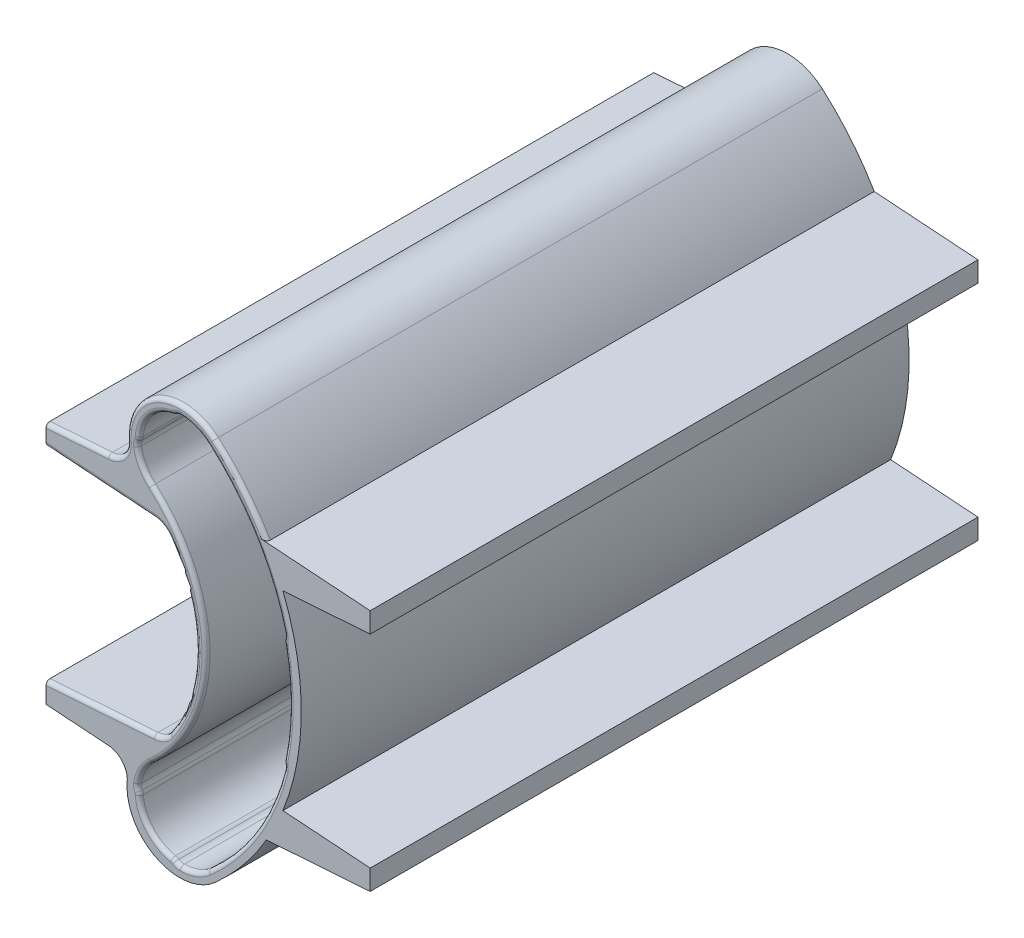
SolidWorks part; units mm, degrees
ref_plane "Front Plane" through (0, 0, 0) normal (0, 0, 1) x (1, 0, 0)
ref_plane "Top Plane" through (0, 0, 0) normal (0, 1, 0) x (1, 0, 0)
ref_plane "Right Plane" through (0, 0, 0) normal (1, 0, 0) x (0, 0, -1)
sketch "Sketch1" plane through (0, 0, 0) normal (0, 0, 1) x (1, 0, 0)
  line L0 (0, 0) -> (126.5517, 0) construction
  line L1 (0, 0) -> (65.9983, -75.128) construction
  line L2 (0, 0) -> (65.9983, 75.128) construction
  arc A9 (48.8388, -55.5947) -> (83.1579, -94.6613) centre (65.9983, -75.128) ccw
  arc A10 (83.1579, -94.6613) -> (83.1579, 94.6613) centre (0, 0) ccw
  arc A11 (83.1579, 94.6613) -> (48.8388, 55.5947) centre (65.9983, 75.128) ccw
  arc A12 (48.8388, -55.5947) -> (48.8388, 55.5947) centre (0, 0) ccw
  arc A13 (52.1387, -59.3512) -> (79.858, -90.9049) centre (65.9983, -75.128) ccw
  arc A14 (52.1387, -59.3512) -> (52.1387, 59.3512) centre (0, 0) ccw
  arc A15 (79.858, 90.9049) -> (52.1387, 59.3512) centre (65.9983, 75.128) ccw
  arc A16 (79.858, -90.9049) -> (79.858, 90.9049) centre (0, 0) ccw
  dimension "D1" = 79
  dimension "D2" = 42
  dimension "D3" = 5
  dimension "D4" = 48.701
extrude "Extrude1" add sketch "Sketch1" along normal blind 300
sketch "Sketch3" plane through (0, 0, 0) normal (1, 0, 0) x (0, 0, -1)
  line L0 (17.1923, 0) -> (-312.4893, 0) construction
  line L1 (0, -55.5947) -> (0, 55.5947) construction
  line L4 (-300, -50) -> (0, -50)
  line L5 (-300, -50) -> (-300, -60)
  line L6 (-300, -60) -> (0, -60)
  line L7 (0, -50) -> (0, -60)
  line L8 (-300, 55.5947) -> (-300, -55.5947) construction
  dimension "D1" = 10
  dimension "D2" = 100
extrude "Extrude2" add sketch "Sketch3" along normal up to body
draft "Draft1" type of draft neutral plane draft angle 4 faces to draft 2 parameters "D1"=4
ref_plane "Plane3" through (160, 0, 0) normal (1, 0, 0) x (0, 0, -1)
sketch "Sketch10" plane through (160, 0, 0) normal (1, 0, 0) x (0, 0, -1)
  line L4 (-300, -50) -> (-300, -60)
  line L5 (0, -50) -> (-300, -50)
  line L6 (0, -60) -> (0, -50)
  line L7 (-300, -60) -> (0, -60)
  line L8 (-300, -50) -> (-300, -60)
  line L9 (0, -50) -> (-300, -50)
  line L10 (0, -60) -> (0, -50)
  line L11 (-300, -60) -> (0, -60)
  dimension "D1" = 0
extrude "Extrude6" add sketch "Sketch10" against normal up to body
draft "Draft2" type of draft neutral plane draft angle 4 faces to draft 2 parameters "D1"=4
mirror "Mirror1" about plane through (0, 0, 0) normal (0, 1, 0) of "Draft2", "Extrude6", "Draft1", "Extrude2"
fillet "Fillet1" radius 10 4 edges at (42.9968, -63.0066, 150) (42.9968, 63.0066, 150) (58.0103, -45.9435, 150) (58.0103, 45.9435, 150)
ref_plane "Plane1" through (0, 0, 50) normal (0, 0, 1) x (1, 0, 0)
sketch "Sketch4" plane through (0, 0, 50) normal (0, 0, 1) x (1, 0, 0)
  line L0 (0, -33.0385) -> (0, 33.0385) construction
  circle A1 centre (65, 0) radius 3.75
  arc A2 (62.9654, 9.7908) -> (62.9654, -9.7908) centre (65, 0) ccw
  arc A3 (60.9541, -41.9594) -> (60.9541, 41.9594) centre (0, 0) ccw construction
  arc A4 (70.4512, -22.6413) -> (70.4512, 22.6413) centre (0, 0) ccw
  arc A5 (70.4512, -22.6413) -> (62.9654, -9.7908) centre (60.9308, -19.5817) ccw
  arc A6 (70.4512, 22.6413) -> (62.9654, 9.7908) centre (60.9308, 19.5817) cw
  point P13 (74, 0)
  dimension "D2" = 7.5
  dimension "D3" = 20
  dimension "D4" = 10
  dimension "D1" = 65
extrude "Extrude3" add sketch "Sketch4" along normal blind 25
sketch "Sketch5" plane through (0, 0, 0) normal (1, 0, 0) x (0, 0, -1)
  line L0 (0, 0) -> (-27.1601, 0) construction
  line L1 (-45, 40) -> (-40, 40)
  line L2 (-45, 40) -> (-45, -40)
  line L3 (-45, -40) -> (-40, -40)
  line L4 (-40, 40) -> (-40, -40)
  line L5 (0, -41.9594) -> (0, 41.9594) construction
  line L6 (-42.5, -40) -> (-42.5, 40) construction
  line L7 (-50, -9.7908) -> (-50, 9.7908) construction
  dimension "D1" = 5
  dimension "D2" = 5
  dimension "D3" = 80
extrude "Cut-Extrude2" cut sketch "Sketch5" along normal up to next contours L2 L3 L4 L1
pattern_linear "LPattern1" count 2 spacing 17.5 along (0, 0, -1) of "Cut-Extrude2"
sketch "Sketch7" plane through (0, 0, 300) normal (0, 0, 1) x (1, 0, 0)
  line L0 (65.9983, -75.128) -> (48.7189, -90.3077) construction
  line L1 (65.9983, 75.128) -> (48.7189, 90.3077) construction
  line L2 (46.0035, 75.5813) -> (43.0042, 75.6493)
  line L3 (62.5188, 97.8633) -> (62.9726, 94.8978)
  line L4 (62.5188, -97.8633) -> (62.9726, -94.8978)
  line L5 (46.0035, -75.5813) -> (43.0042, -75.6493)
  line L10 (0, 0) -> (123, 0) construction
  line L12 (117.1555, -25.9728) -> (120.0844, -26.6221)
  line L13 (120.0844, 26.6221) -> (117.1555, 25.9728)
  arc A0 (43.0042, 75.6493) -> (62.5188, 97.8633) centre (65.9983, 75.128) cw
  arc A1 (46.0035, 75.5813) -> (62.9726, 94.8978) centre (65.9983, 75.128) cw
  arc A2 (46.0035, -75.5813) -> (62.9726, -94.8978) centre (65.9983, -75.128) ccw
  arc A6 (43.0042, -75.6493) -> (62.5188, -97.8633) centre (65.9983, -75.128) ccw
  arc A11 (79.858, -90.9049) -> (79.858, 90.9049) centre (0, 0) ccw construction
  arc A12 (120.0844, -26.6221) -> (120.0844, 26.6221) centre (0, 0) ccw
  arc A13 (117.1555, -25.9728) -> (117.1555, 25.9728) centre (0, 0) ccw
  arc A15 (52.1387, -59.3512) -> (79.858, -90.9049) centre (65.9983, -75.128) ccw construction
  dimension "D1" = 3
  dimension "D2" = 1
  dimension "D3" = 1
  dimension "D4" = 2
  dimension "D5" = 80
  dimension "D6" = 25
extrude "Extrude4" add sketch "Sketch7" against normal up to surface (300 mm away)
fillet "Fillet2" radius 5 6 edges at (118.1318, 26.1892, 150) (118.1318, -26.1892, 150) (62.8213, -95.8863, 150) (45.0037, -75.604, 150) (45.0037, 75.604, 150) (62.8213, 95.8863, 150)
fillet "Fillet3" radius 5 6 edges at (62.9726, 94.8978, 150) (46.0035, 75.5813, 150) (46.0035, -75.5813, 150) (62.9726, -94.8978, 150) (117.1555, 25.9728, 150) (117.1555, -25.9728, 150)
fillet "Fillet4" radius 2 62 edges at (26.7073, 48.1324, 0) (26.7073, 48.1324, 300) (57.676, 44.9731, 0) (57.676, 44.9731, 300) (74, 0, 0) (74, 0, 300) (57.676, -44.9731, 0) (57.676, -44.9731, 300) (15.4104, -61.0776, 0) (37.7146, -65.6215, 0) (97.2196, -80.152, 0) (97.2196, 80.152, 300) (73.5612, -94.7189, 0) (73.5612, -94.7189, 300) (64.9205, -95.9446, 0) (64.9205, -95.9446, 300) (62.8257, -94.9734, 0) (62.8257, -94.9734, 300) (50.9727, -88.3277, 0) (45.9096, -75.7173, 0) (45.9096, -75.7173, 300) (45.2163, -73.5148, 300) (45.2163, -73.5148, 0) (47.5452, -65.104, 300) (47.5452, -65.104, 0) (79, 0, 0) (79, 0, 300) (47.5452, 65.104, 0) (47.5452, 65.104, 300) (45.2163, 73.5148, 0) (45.2163, 73.5148, 300) (45.9096, 75.7173, 0) (45.9096, 75.7173, 300) (50.9727, 88.3277, 0) (62.8257, 94.9734, 0) (62.8257, 94.9734, 300) (64.9205, 95.9446, 300) (64.9205, 95.9446, 0) (73.5612, 94.7189, 300) (73.5612, 94.7189, 0) (103.3575, 62.9144, 0) (103.3575, 62.9144, 300) (117.5752, 28.0226, 0) (117.5752, 28.0226, 300) (117.3216, 25.7849, 0) (117.3216, 25.7849, 300) (120, 0, 0) (117.3216, -25.7849, 0) (117.3216, -25.7849, 300) (117.5752, -28.0226, 300) (117.5752, -28.0226, 0) (26.7073, -48.1324, 300) (15.4104, 61.0776, 300) (37.7146, 65.6215, 300) (120, 0, 300) (103.3575, -62.9144, 300) (103.3575, -62.9144, 0) (50.9727, -88.3277, 300) (50.9727, 88.3277, 300) (26.7073, -48.1324, 0) (54.3004, -98.3478, 0) (54.3004, 98.3478, 300)
fillet "Fillet5" radius 2.5 6 edges at (69.5716, 14.5481, 50) (55, 0, 50) (69.5716, 14.5481, 75) (55, 0, 75) (69.5716, -14.5481, 50) (69.5716, -14.5481, 75)
fillet "Fillet6" radius 2 6 edges at (71.7237, -18.2131, 50.5965) (71.7237, 18.2131, 50.5965) (71.7237, -18.2131, 74.4035) (71.7237, 18.2131, 74.4035) (74, 0, 50) (74, 0, 75)
ref_plane "Plane2" through (0, 0, 104) normal (0, 0, -1) x (-1, 0, 0)
sketch "Sketch8" plane through (0, 0, 104) normal (0, 0, -1) x (-1, 0, 0)
  line L3 (0, 0) -> (-54.25, 0) construction
  line L4 (-60.6048, 24.1788) -> (-60.6048, -24.1788) construction
  line L6 (-36.4496, 26.4026) -> (-66.1706, 33.1279)
  line L7 (-66.1706, -33.1279) -> (-36.4496, -26.4026)
  line L8 (-30.6048, -19.0875) -> (-30.6048, 19.0875)
  arc A5 (-60.9541, 41.9594) -> (-60.9541, -41.9594) centre (0, 0) ccw construction
  arc A6 (-66.1706, 33.1279) -> (-66.1706, -33.1279) centre (0, 0) ccw
  circle A7 centre (-54.25, 0) radius 25 construction
  circle A12 centre (-60.6048, -24.1788) radius 2.5
  arc A13 (-36.4496, -26.4026) -> (-30.6048, -19.0875) centre (-38.1048, -19.0875) ccw
  arc A14 (-30.6048, 19.0875) -> (-36.4496, 26.4026) centre (-38.1048, 19.0875) ccw
  circle A15 centre (-38.1048, -19.0875) radius 2.5
  circle A16 centre (-38.1048, 19.0875) radius 2.5
  circle A17 centre (-60.6048, 24.1788) radius 2.5
  dimension "D1" = 30.6048
  dimension "D3" = 7.5
  dimension "D5" = 50
  dimension "D6" = 5
  dimension "D2" = 25.5
  dimension "D4" = 38.1751
  dimension "D7" = 48.3577
extrude "Extrude5" add sketch "Sketch8" along normal blind 5
fillet "Fillet7" radius 5 2 edges at (66.1706, 33.1279, 101.5) (66.1706, -33.1279, 101.5)
sketch "Sketch9" plane through (0, 0, 99) normal (0, 0, -1) x (-1, 0, 0)
  circle A1 centre (-54.25, 0) radius 17.5
  dimension "D1" = 35
extrude "Cut-Extrude3" cut sketch "Sketch9" against normal up to next
sketch "Sketch11" plane through (0, 0, 75) normal (0, 0, 1) x (1, 0, 0)
  circle A0 centre (65, 0) radius 3.75 construction
  circle A1 centre (65, 0) radius 3.75
  circle A2 centre (65, 0) radius 6
  dimension "D1" = 12
extrude "Extrude7" add sketch "Sketch11" along normal blind 4
